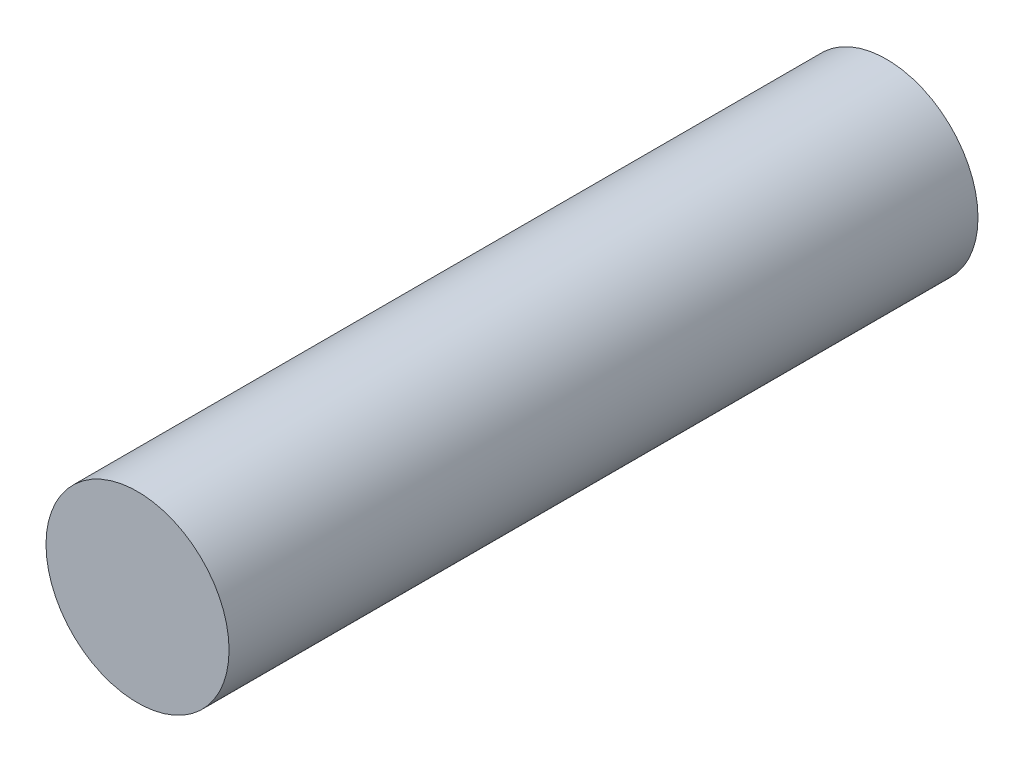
SolidWorks part; units mm, degrees
ref_plane "Face" through (0, 0, 0) normal (0, 0, 1) x (1, 0, 0)
ref_plane "Dessus" through (0, 0, 0) normal (0, 1, 0) x (1, 0, 0)
ref_plane "Droite" through (0, 0, 0) normal (1, 0, 0) x (0, 0, -1)
ref_plane "Plan4" through (0, 0, -13.5) normal (0, 0, -1) x (-1, 0, 0)
sketch "Esquisse1" plane through (0, 0, -13.5) normal (0, 0, -1) x (-1, 0, 0)
  circle A0 centre (0, 0) radius 1.65
extrude "Base-Extrusion" add sketch "Esquisse1" against normal mid plane 13.5
